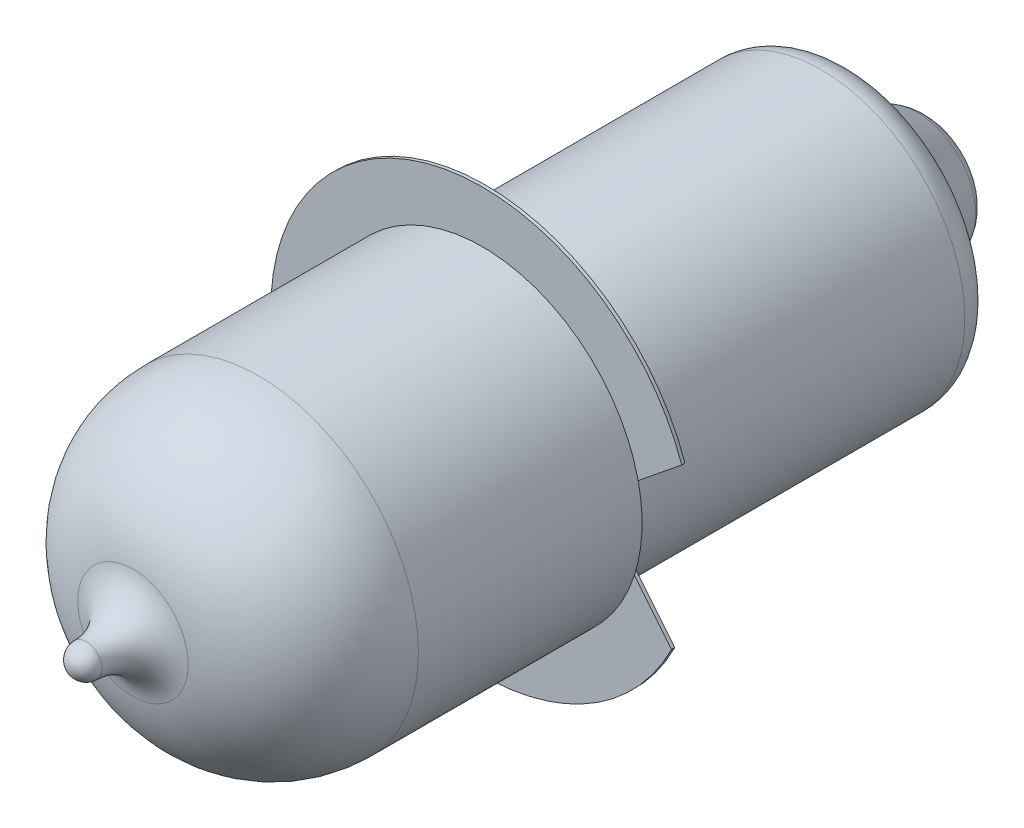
SolidWorks part; units mm, degrees
ref_plane "Plan1" through (0, 0, 0) normal (0, 0, 1) x (1, 0, 0)
ref_plane "Plan2" through (0, 0, 0) normal (0, 1, 0) x (1, 0, 0)
ref_plane "Plan3" through (0, 0, 0) normal (1, 0, 0) x (0, 0, -1)
sketch "Esquisse1" plane through (0, 0, 0) normal (0, 0, 1) x (1, 0, 0)
  circle A0 centre (0, 0) radius 4.5
  dimension "D1" = 9
extrude "Base-Extrusion" add sketch "Esquisse1" along normal blind 11.5
sketch "Esquisse2" plane through (0, 0, 11.5) normal (0, 0, 1) x (1, 0, 0)
  circle A0 centre (0, 0) radius 6.62
  dimension "D1" = 13.24
extrude "Boss.-Extru.1" add sketch "Esquisse2" along normal blind 0.1
sketch "Esquisse3" plane through (0, 0, 0) normal (0, 0, -1) x (-1, 0, 0)
  circle A0 centre (0, 0) radius 3
  dimension "D1" = 6
extrude "Boss.-Extru.2" add sketch "Esquisse3" along normal blind 2.5 draft 30
fillet "Congé1" radius 1
sketch "Esquisse4" plane through (0, 0, 11.6) normal (0, 0, 1) x (1, 0, 0)
  line L0 (6.2424, 2.2038) -> (3.5252, -0.0023)
  line L1 (3.5252, -0.0023) -> (5.9234, -2.956)
  circle A0 centre (0, 0) radius 6.62 construction
  arc A1 (5.9234, -2.956) -> (6.2424, 2.2038) centre (0, 0) ccw
  dimension "D1" = 3.5
  dimension "D2" = 90
extrude "Enlèv. mat.-Extru.1" cut sketch "Esquisse4" against normal blind 0.1
sketch "Esquisse5" plane through (0, 0, 11.6) normal (0, 0, 1) x (1, 0, 0)
  circle A0 centre (0, 0) radius 5
  dimension "D1" = 10
extrude "Boss.-Extru.3" add sketch "Esquisse5" along normal blind 11
fillet "Congé2" radius 4
sketch "Esquisse8" plane through (0, 0, 0) normal (1, 0, 0) x (0, 0, -1)
  line L1 (-24.5, 0) -> (-21.5, 0) construction
  line L4 (-21.5, 3) -> (-21.5, 0)
  line L5 (-21.5, 0) -> (-24.5, 0)
  arc A1 (-24, 0.5) -> (-21.5, 3) centre (-24, 3) ccw
  arc A2 (-24, 0.5) -> (-24.5, 0) centre (-24, 0) ccw
  dimension "D1" = 24
  dimension "D2" = 24
  dimension "D3" = 1
  dimension "D4" = 5
revolve "Boss.-Révol.1" add sketch "Esquisse8" angle 360 about L1
fillet "Congé3" radius 1.5
